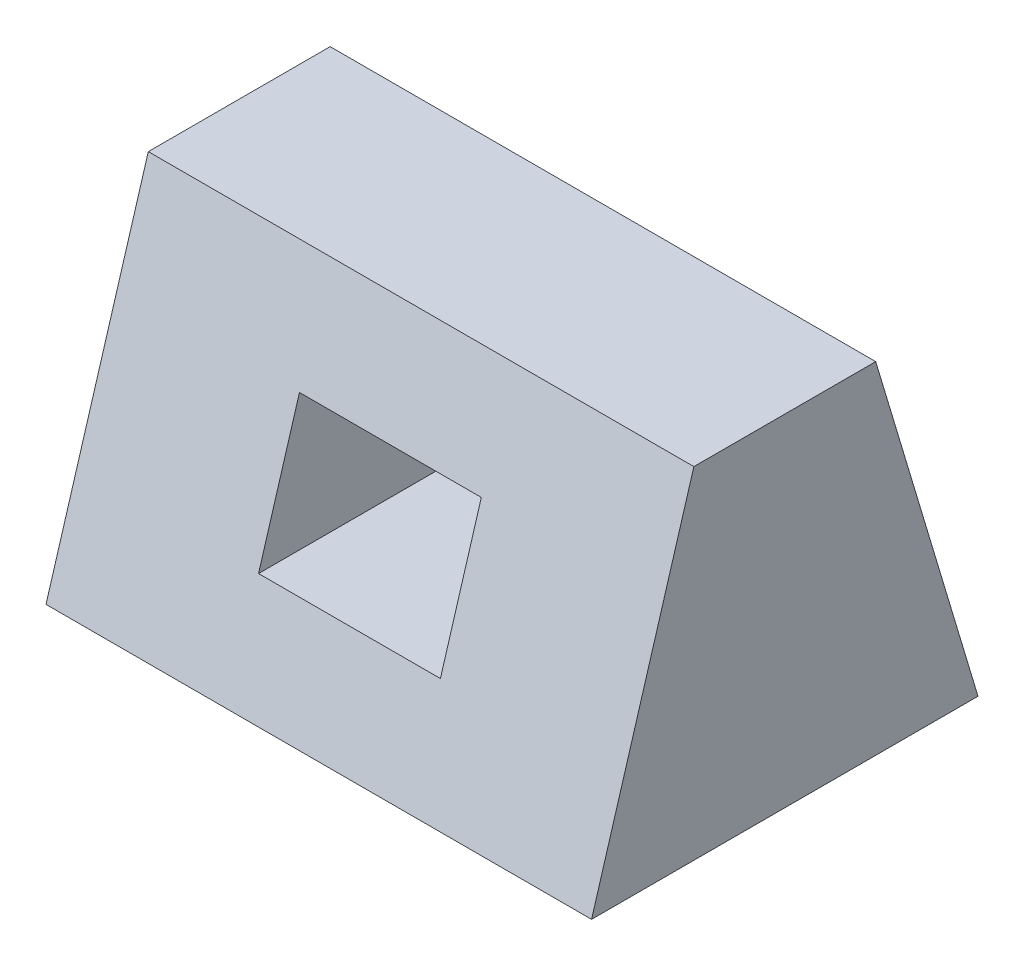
SolidWorks part; units mm, degrees
ref_plane "前视基准面" through (0, 0, 0) normal (0, 0, 1) x (1, 0, 0)
ref_plane "上视基准面" through (0, 0, 0) normal (0, 1, 0) x (1, 0, 0)
ref_plane "右视基准面" through (0, 0, 0) normal (1, 0, 0) x (0, 0, -1)
sketch "草图1" plane through (0, 0, 0) normal (1, 0, 0) x (0, 0, -1)
  line L0 (-42.5, 0) -> (42.5, 0)
  line L1 (42.5, 0) -> (20, 75)
  line L2 (20, 75) -> (-20, 75)
  line L3 (-20, 75) -> (-42.5, 0)
  line L4 (0, -59.4126) -> (0, 96.3448) construction
  dimension "D1" = 75
  dimension "D2" = 40
  dimension "D3" = 85
extrude "拉伸1" add sketch "草图1" along normal blind 120
sketch "草图3" plane through (0, 0, 0) normal (0, 0, 1) x (1, 0, 0)
  line L0 (0, 75) -> (0, 0) construction
  line L1 (40, 52.5) -> (80, 52.5)
  line L2 (40, 52.5) -> (40, 22.5)
  line L3 (40, 22.5) -> (80, 22.5)
  line L4 (80, 52.5) -> (80, 22.5)
  line L5 (0, 37.5) -> (123.7931, 37.5) construction
  dimension "D1" = 40
  dimension "D2" = 80
  dimension "D3" = 15
extrude "切除-拉伸2" cut sketch "草图3" against normal mid plane 80
